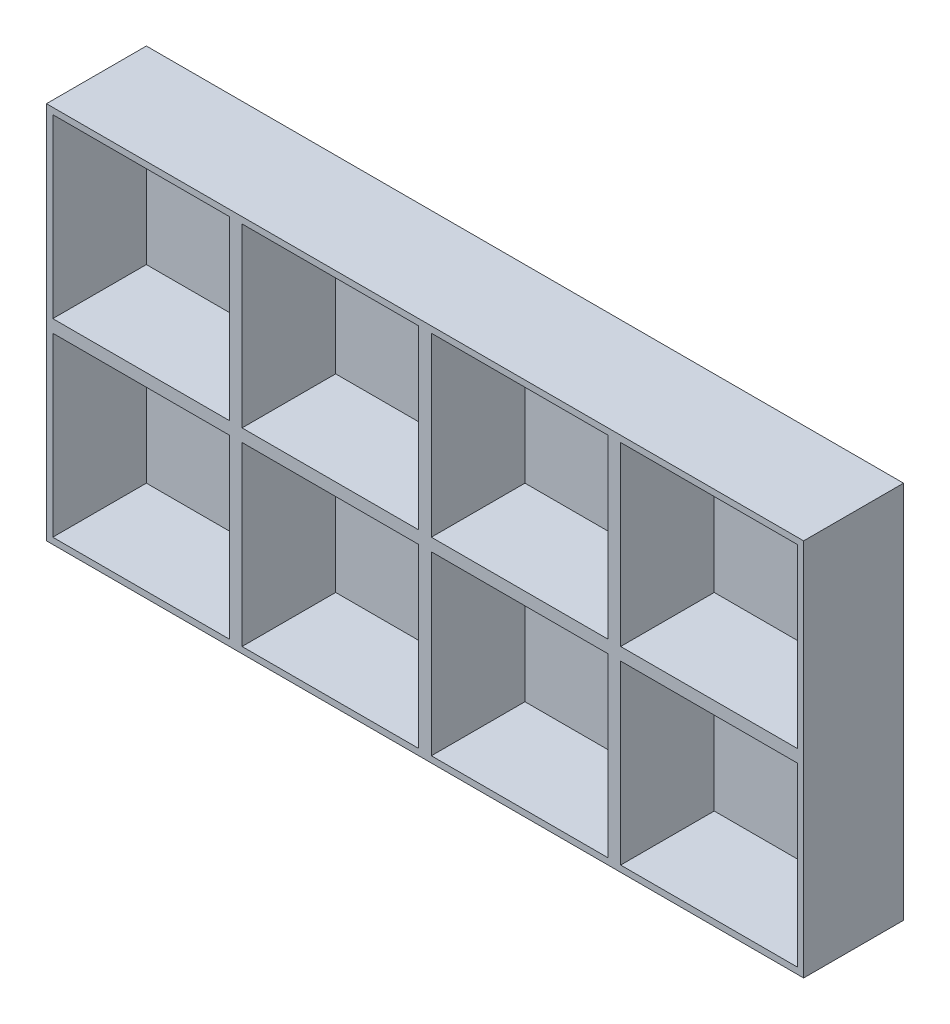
SolidWorks part; units mm, degrees
ref_plane "Plan de face" through (0, 0, 0) normal (0, 0, 1) x (1, 0, 0)
ref_plane "Plan de dessus" through (0, 0, 0) normal (0, 1, 0) x (1, 0, 0)
ref_plane "Plan de droite" through (0, 0, 0) normal (1, 0, 0) x (0, 0, -1)
sketch "Esquisse1" plane through (0, 0, 0) normal (0, 0, 1) x (1, 0, 0)
  line L0 (0, 0) -> (0, 30)
  line L16 (59, 1) -> (59, 29)
  line L17 (59, 29) -> (31, 29)
  line L18 (31, 29) -> (31, 1)
  line L20 (29, 1) -> (29, 29)
  line L21 (29, 29) -> (1, 29)
  line L22 (1, 29) -> (1, 1)
  line L24 (0, 30) -> (120, 30)
  line L25 (60, 30) -> (60, 1) construction
  line L27 (119, 29) -> (119, 1)
  line L28 (91, 29) -> (119, 29)
  line L29 (91, 1) -> (91, 29)
  line L31 (89, 29) -> (89, 1)
  line L32 (61, 29) -> (89, 29)
  line L33 (61, 1) -> (61, 29)
  line L34 (120, 0) -> (120, 30)
  line L35 (0, 0) -> (120, 0)
  line L36 (1, 1) -> (29, 1)
  line L37 (29, 29) -> (31, 29) construction
  line L38 (59, 29) -> (61, 29) construction
  line L39 (89, 29) -> (91, 29) construction
  line L41 (119, 1) -> (120, 1) construction
  line L42 (91, 1) -> (119, 1)
  line L43 (61, 1) -> (89, 1)
  line L44 (31, 1) -> (59, 1)
  dimension "D1" = 1
  dimension "D2" = 1
  dimension "D3" = 2
  dimension "D4" = 30
  dimension "D5" = 1
  dimension "D6" = 28
  dimension "D7" = 28
extrude "Boss.-Extru.1" add sketch "Esquisse1" along normal blind 14.8333 contours L0 L35 L34 L24 L44 L18 L17 L16 L43 L33 L32 L31 L42 L29 L28 L27 L36 L22 L21 L20
mirror "Symétrie1" about plane through (0, 0, 14.8333) normal (0, 1, 0) of "Boss.-Extru.1"
sketch "Esquisse2" plane through (0, 0, 0) normal (0, 0, -1) x (-1, 0, 0)
  line L1 (-120, 30) -> (0, 30)
  line L2 (-120, 30) -> (-120, -30)
  line L3 (-120, -30) -> (0, -30)
  line L4 (0, 30) -> (0, -30)
extrude "Boss.-Extru.2" add sketch "Esquisse2" along normal blind 1
